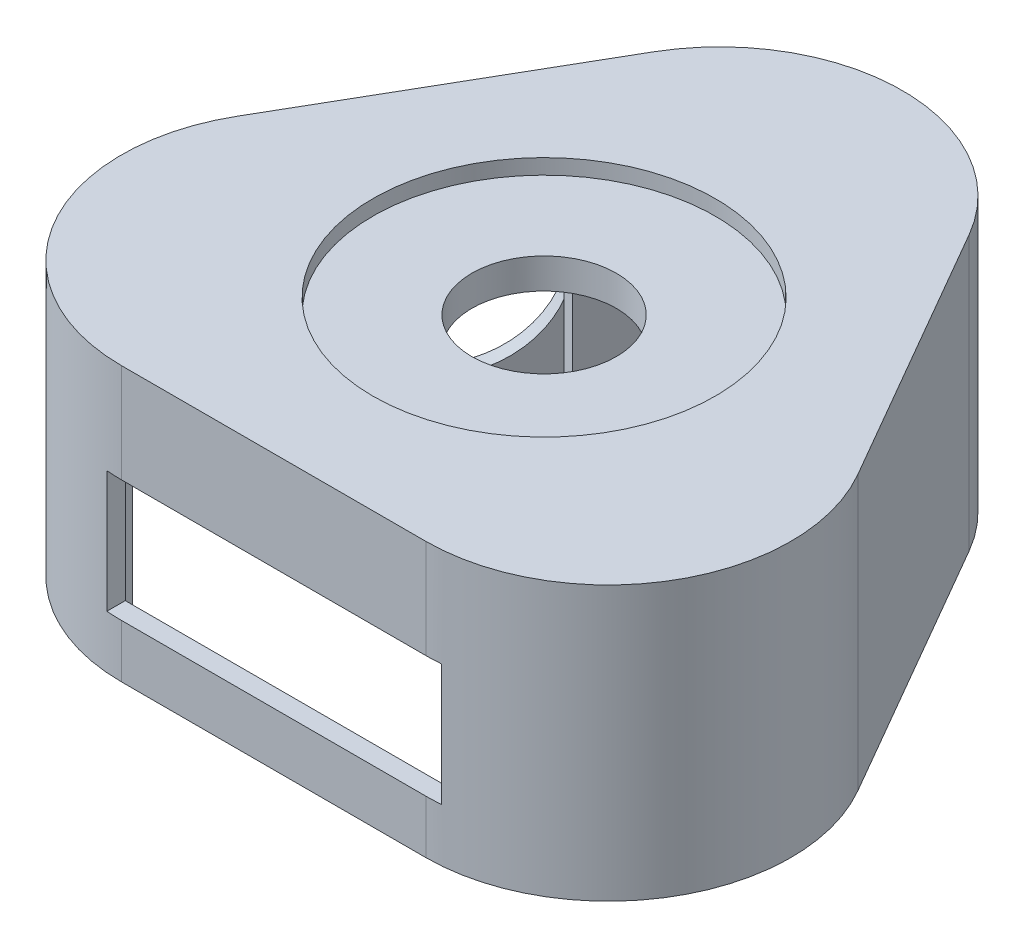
SolidWorks part; units mm, degrees
ref_plane "Спереди" through (0, 0, 0) normal (0, 0, 1) x (1, 0, 0)
ref_plane "Сверху" through (0, 0, 0) normal (0, 1, 0) x (1, 0, 0)
ref_plane "Справа" through (0, 0, 0) normal (1, 0, 0) x (0, 0, -1)
sketch "Эскиз1" plane through (0, 0, 0) normal (0, 1, 0) x (1, 0, 0)
  line L0 (0, 0) -> (0, 11.547) construction
  line L1 (0, 0) -> (10, -5.7735) construction
  line L2 (0, 0) -> (-10, -5.7735) construction
  line L3 (10.3923, 17.547) -> (20.3923, 0.2265)
  line L4 (10, -17.7735) -> (-10, -17.7735)
  line L5 (-10.3923, 17.547) -> (-20.3923, 0.2265)
  arc A0 (-10.3923, 17.547) -> (10.3923, 17.547) centre (0, 11.547) cw
  arc A1 (20.3923, 0.2265) -> (10, -17.7735) centre (10, -5.7735) cw
  arc A2 (-20.3923, 0.2265) -> (-10, -17.7735) centre (-10, -5.7735) ccw
  dimension "D1" = 12
  dimension "D5" = 41.3205
  dimension "D6" = 44
  dimension "D2" = 120
  dimension "D3" = 120
  dimension "D4" = 20
extrude "Бобышка-Вытянуть1" add sketch "Эскиз1" along normal blind 18
sketch "Эскиз2" plane through (0, 0, 0) normal (0, -1, 0) x (1, 0, 0)
  line L0 (-10, 15.2735) -> (10, 15.2735)
  line L1 (18.2272, 1.0235) -> (8.2272, -16.297)
  line L2 (18.2272, 10.5235) -> (-15.3923, -8.8868) construction
  line L4 (-8.2272, -16.297) -> (-18.2272, 1.0235)
  line L6 (-10.3923, -17.547) -> (-20.3923, -0.2265) construction
  arc A0 (18.2272, 1.0235) -> (10, 15.2735) centre (10, 5.7735) ccw
  arc A1 (-10, 15.2735) -> (-18.2272, 1.0235) centre (-10, 5.7735) ccw
  arc A2 (-8.2272, -16.297) -> (8.2272, -16.297) centre (0, -11.547) ccw
  arc A3 (20.3923, -0.2265) -> (10, 17.7735) centre (10, 5.7735) ccw construction
  arc A4 (-10, 17.7735) -> (-20.3923, -0.2265) centre (-10, 5.7735) ccw construction
  arc A5 (-10.3923, -17.547) -> (10.3923, -17.547) centre (0, -11.547) ccw construction
  dimension "D1" = 19
extrude "Вырез-Вытянуть1" cut sketch "Эскиз2" against normal offset from surface (15 mm away) 3
sketch "Эскиз3" plane through (0, 0, 0) normal (0, -1, 0) x (1, 0, 0)
  line L12 (9.3098, -16.922) -> (19.3098, 0.3985)
  line L13 (10, 16.5235) -> (-10, 16.5235)
  line L14 (-19.3098, 0.3985) -> (-9.3098, -16.922)
  line L15 (9.3098, -16.922) -> (19.3098, 0.3985)
  line L16 (10, 16.5235) -> (-10, 16.5235)
  line L17 (-19.3098, 0.3985) -> (-9.3098, -16.922)
  arc A15 (19.3098, 0.3985) -> (10, 16.5235) centre (10, 5.7735) ccw
  arc A16 (-10, 16.5235) -> (-19.3098, 0.3985) centre (-10, 5.7735) ccw
  arc A17 (-9.3098, -16.922) -> (9.3098, -16.922) centre (0, -11.547) ccw
  arc A18 (19.3098, 0.3985) -> (10, 16.5235) centre (10, 5.7735) ccw
  arc A19 (-10, 16.5235) -> (-19.3098, 0.3985) centre (-10, 5.7735) ccw
  arc A20 (-9.3098, -16.922) -> (9.3098, -16.922) centre (0, -11.547) ccw
  dimension "D1" = 1.25
extrude "Вырез-Вытянуть2" cut sketch "Эскиз3" against normal blind 1.5
sketch "Эскиз4" plane through (0, 15, 0) normal (0, -1, 0) x (1, 0, 0)
  circle A0 centre (0, 0) radius 4.75
  dimension "D1" = 9.5
extrude "Вырез-Вытянуть3" cut sketch "Эскиз4" against normal through all
sketch "Эскиз5" plane through (-15.3923, 0, -8.8868) normal (-0.866, 0, -0.5) x (-0.5, 0, 0.866)
  line L0 (0, 0) -> (0, 8.7) construction
  line L1 (-10, 0) -> (10, 0) construction
  line L2 (-10, 18) -> (10, 18) construction
  circle A0 centre (0, 8.7) radius 5.5
  dimension "D1" = 11
  dimension "D2" = 9.3
extrude "Вырез-Вытянуть4" cut sketch "Эскиз5" against normal up to next
sketch "Эскиз7" plane through (0, 18, 0) normal (0, 1, 0) x (1, 0, 0)
  circle A0 centre (0, 0) radius 11.25
  dimension "D1" = 22.5
extrude "Вырез-Вытянуть6" cut sketch "Эскиз7" against normal blind 1
sketch "Эскиз8" plane through (0, 0, 17.7735) normal (0, 0, 1) x (1, 0, 0)
  line L0 (0, 0) -> (0, 18) construction
  line L1 (-10, 18) -> (10, 18) construction
  line L3 (-11, 11.5) -> (11, 11.5)
  line L4 (-11, 11.5) -> (-11, 3.5)
  line L5 (-11, 3.5) -> (11, 3.5)
  line L6 (11, 11.5) -> (11, 3.5)
  dimension "D1" = 8
  dimension "D2" = 22
  dimension "D3" = 6.5
extrude "Вырез-Вытянуть7" cut sketch "Эскиз8" against normal up to next
sketch "Эскиз9" plane through (0, 0, 15.2735) normal (0, 0, -1) x (-1, 0, 0)
  line L0 (10, 11.5) -> (-10, 11.5) construction
  line L1 (12, 1.5) -> (-12, 1.5)
  line L2 (12, 1.5) -> (12, 12.5)
  line L3 (12, 12.5) -> (-12, 12.5)
  line L4 (-12, 1.5) -> (-12, 12.5)
  line L5 (-11, 11.5) -> (-11, 3.5) construction
  line L6 (11, 3.5) -> (11, 11.5) construction
  line L7 (-10, 3.5) -> (10, 3.5) construction
  dimension "D1" = 1
  dimension "D2" = 1
  dimension "D3" = 1
  dimension "D4" = 2
extrude "Вырез-Вытянуть8" cut sketch "Эскиз9" against normal mid plane 2.5
chamfer "Фаска1" distance 1.5 angle 45 1 edges at (-18.1423, 8.7, -4.1236)
sketch "Эскиз10" plane through (0, 15, 0) normal (0, -1, 0) x (1, 0, 0)
  line L0 (0, 0) -> (-13.2272, -7.6368) construction
  line L1 (-8.2272, -16.297) -> (-18.2272, 1.0235) construction
  line L2 (-17.2272, -0.7085) -> (-15.9772, -2.8736)
  line L3 (-9.2272, -14.565) -> (-2.9053, -10.915)
  line L4 (-2.9053, -10.915) -> (-5.1553, -7.0178)
  line L5 (-5.1553, -7.0178) -> (-6.4543, -7.7678)
  line L6 (-6.4543, -7.7678) -> (-5.0793, -10.1494)
  line L7 (-5.0793, -10.1494) -> (-8.1104, -11.8994)
  line L8 (-8.1104, -11.8994) -> (-8.4854, -11.2499)
  line L9 (-8.4854, -11.2499) -> (-10.4772, -12.3999)
  line L10 (-13.9854, -1.7236) -> (-15.9772, -2.8736)
  line L11 (-14.3604, -1.0741) -> (-13.9854, -1.7236)
  line L12 (-11.3293, 0.6759) -> (-14.3604, -1.0741)
  line L13 (-9.9543, -1.7057) -> (-11.3293, 0.6759)
  line L14 (-8.6553, -0.9557) -> (-9.9543, -1.7057)
  line L15 (-10.9053, 2.9415) -> (-8.6553, -0.9557)
  line L16 (-17.2272, -0.7085) -> (-10.9053, 2.9415)
  line L17 (-10.4772, -12.3999) -> (-9.2272, -14.565)
  line L19 (-8.2272, -16.297) -> (-18.2272, 1.0235) construction
  dimension "D1" = 7
  dimension "D2" = 7.3
  dimension "D3" = 3.5
  dimension "D5" = 1.5
  dimension "D6" = 11
  dimension "D7" = 12.5
  dimension "D8" = 16
extrude "Бобышка-Вытянуть2" add sketch "Эскиз10" along normal blind 13.5
